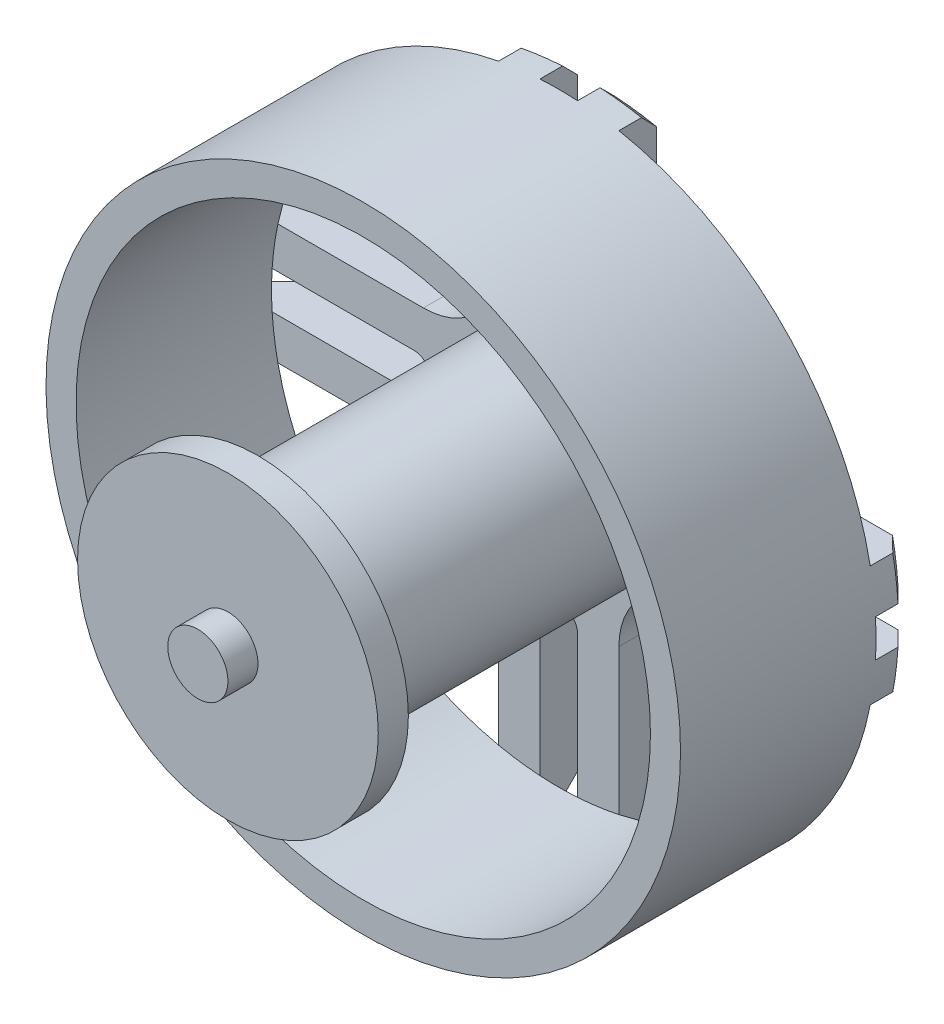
SolidWorks part; units mm, degrees
ref_plane "Front Plane" through (0, 0, 0) normal (0, 0, 1) x (1, 0, 0)
ref_plane "Top Plane" through (0, 0, 0) normal (0, 1, 0) x (1, 0, 0)
ref_plane "Right Plane" through (0, 0, 0) normal (1, 0, 0) x (0, 0, -1)
sketch "Sketch1" plane through (0, 0, 0) normal (0, 0, 1) x (1, 0, 0)
  circle A0 centre (0, 0) radius 21.1
  dimension "D1" = 42.2
extrude "Boss-Extrude1" add sketch "Sketch1" along normal blind 15.5
sketch "Sketch2" plane through (0, 0, 15.5) normal (0, 0, 1) x (1, 0, 0)
  circle A0 centre (0, 0) radius 19.1
  dimension "D1" = 38.2
extrude "Cut-Extrude1" cut sketch "Sketch2" against normal blind 13
sketch "Sketch3" plane through (0, 0, 2.5) normal (0, 0, 1) x (1, 0, 0)
  circle A0 centre (0, 0) radius 7
  dimension "D1" = 14
extrude "Boss-Extrude2" add sketch "Sketch3" along normal blind 20
sketch "Sketch4" plane through (0, 0, 22.5) normal (0, 0, 1) x (1, 0, 0)
  circle A0 centre (0, 0) radius 10
  dimension "D1" = 20
extrude "Boss-Extrude3" add sketch "Sketch4" along normal blind 2
sketch "Sketch5" plane through (0, 0, 0) normal (0, 0, -1) x (-1, 0, 0)
  line L0 (-27.281, 0) -> (29.1843, 0) construction
  line L1 (0, 22.713) -> (0, -23.3475) construction
  line L2 (4, -4) -> (4, -20.7174)
  line L3 (4, -4) -> (20.7174, -4)
  line L4 (20.7174, -4) -> (20.7174, -20.7174)
  line L5 (20.7174, -20.7174) -> (4, -20.7174)
  line L6 (-20.72, -4) -> (-4.0026, -4)
  line L7 (-20.72, -4) -> (-20.72, -20.7174)
  line L8 (-4.0026, -4) -> (-4.0026, -20.7174)
  line L9 (-4.0026, -20.7174) -> (-20.72, -20.7174)
  line L10 (-20.72, 20.72) -> (-4.0026, 20.72)
  line L11 (-20.72, 20.72) -> (-20.72, 4.0026)
  line L12 (-4.0026, 20.72) -> (-4.0026, 4.0026)
  line L13 (-4.0026, 4.0026) -> (-20.72, 4.0026)
  line L14 (4, 20.72) -> (20.7174, 20.72)
  line L15 (4, 20.72) -> (4, 4.0026)
  line L16 (20.7174, 20.72) -> (20.7174, 4.0026)
  line L17 (20.7174, 4.0026) -> (4, 4.0026)
  line L19 (33.6, 1.25) -> (8.6, 1.25)
  line L20 (33.6, 1.25) -> (33.6, -1.25)
  line L21 (33.6, -1.25) -> (8.6, -1.25)
  line L22 (8.6, 1.25) -> (8.6, -1.25)
  line L23 (21.1, -1.25) -> (21.1, 1.25) construction
  line L24 (33.6, 0) -> (8.6, 0) construction
  line L36 (1.25, -33.6) -> (1.25, -8.6)
  line L37 (1.25, -33.6) -> (-1.25, -33.6)
  line L38 (-1.25, -33.6) -> (-1.25, -8.6)
  line L39 (1.25, -8.6) -> (-1.25, -8.6)
  line L40 (-33.6, -1.25) -> (-8.6, -1.25)
  line L41 (-33.6, -1.25) -> (-33.6, 1.25)
  line L42 (-33.6, 1.25) -> (-8.6, 1.25)
  line L43 (-8.6, -1.25) -> (-8.6, 1.25)
  line L44 (-1.25, 33.6) -> (-1.25, 8.6)
  line L45 (-1.25, 33.6) -> (1.25, 33.6)
  line L46 (1.25, 33.6) -> (1.25, 8.6)
  line L47 (-1.25, 8.6) -> (1.25, 8.6)
  circle A0 centre (0, 0) radius 21.1 construction
  point P9 (21.1, 0)
  point P42 (1, 0)
  point P43 (0, 0)
  dimension "D1" = 4
  dimension "D2" = 4
  dimension "D3" = 2
  dimension "D5" = 25
  dimension "D6" = 2.5
  dimension "D4" = 2
  dimension "D7" = 4
extrude "Cut-Extrude2" cut sketch "Sketch5" against normal blind 2.5
sketch "Sketch6" plane through (0, 0, 0) normal (0, 0, -1) x (-1, 0, 0)
  circle A0 centre (0, 0) radius 2
  dimension "D1" = 4
extrude "Boss-Extrude4" add sketch "Sketch6" along normal blind 10
sketch "Sketch7" plane through (0, 0, 24.5) normal (0, 0, 1) x (1, 0, 0)
  circle A0 centre (0, 0) radius 2
  dimension "D1" = 4
extrude "Boss-Extrude5" add sketch "Sketch7" along normal blind 2
chamfer "Chamfer1" distance 1 angle 45 8 edges at (20.9354, -2.6307, 0) (20.9352, 2.632, 0) (2.632, -20.9352, 0) (-2.6307, -20.9354, 0) (-20.9354, -2.6307, 0) (-20.9352, 2.632, 0) (-2.6307, 20.9354, 0) (2.632, 20.9352, 0)
fillet "Fillet1" radius 5 4 edges at (-4, 4.0026, 1.25) (4.0026, 4.0026, 1.25) (4.0026, -4, 1.25) (-4, -4, 1.25)
sketch "Sketch9" plane through (0, 0, 0) normal (0, 0, -1) x (-1, 0, 0)
  circle A0 centre (0, 0) radius 1.5489
  circle A1 centre (0, 0) radius 6 construction
  circle A2 centre (0, 6) radius 1.5
  circle A3 centre (6, 0) radius 1.5
  circle A4 centre (0, -6) radius 1.5
  circle A5 centre (-6, 0) radius 1.5
  point P15 (0, 0)
  dimension "D1" = 12
  dimension "D2" = 3
  dimension "D3" = 4
extrude "Cut-Extrude4" cut sketch "Sketch9" against normal blind 2
fillet "Fillet2" radius 1 8 edges at (1.25, -8.6, 1.25) (-1.25, -8.6, 1.25) (8.6, -1.25, 1.25) (8.6, 1.25, 1.25) (-8.6, -1.25, 1.25) (-8.6, 1.25, 1.25) (-1.25, 8.6, 1.25) (1.25, 8.6, 1.25)
